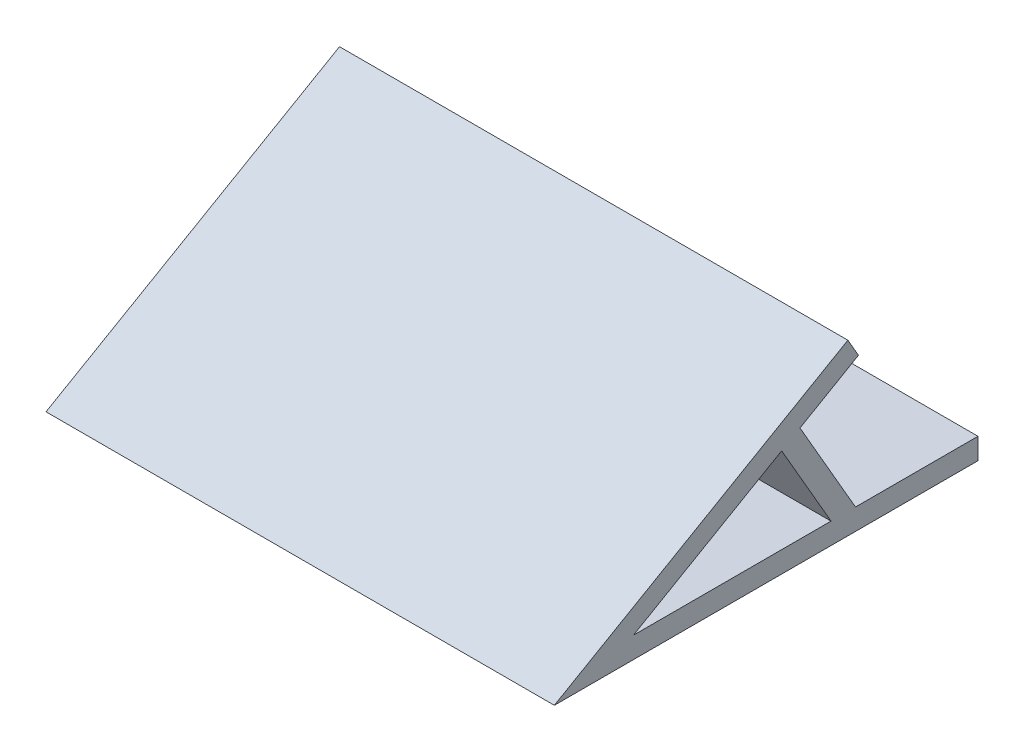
SolidWorks part; units mm, degrees
ref_plane "Front Plane" through (0, 0, 0) normal (0, 0, 1) x (1, 0, 0)
ref_plane "Top Plane" through (0, 0, 0) normal (0, 1, 0) x (1, 0, 0)
ref_plane "Right Plane" through (0, 0, 0) normal (1, 0, 0) x (0, 0, -1)
sketch "Sketch1" plane through (0, 0, 0) normal (1, 0, 0) x (0, 0, -1)
  line L0 (0, 0) -> (-41.0994, 0)
  line L1 (-41.0994, 0) -> (-6.4584, 20)
  line L2 (-6.4584, 20) -> (-5.2084, 17.8349)
  line L3 (-5.2084, 17.8349) -> (-12.1104, 13.85)
  line L4 (-31.7693, 2.5) -> (-8.4442, 2.5)
  line L5 (8.9006, 2.5) -> (8.9006, 0)
  line L6 (8.9006, 0) -> (0, 0)
  line L7 (-14.2755, 12.6) -> (-8.4442, 2.5)
  line L8 (-12.1104, 13.85) -> (-5.5575, 2.5)
  line L9 (-12.1104, 13.85) -> (-14.2755, 12.6) construction
  line L10 (-14.2755, 12.6) -> (-31.7693, 2.5)
  line L11 (-8.4442, 2.5) -> (-5.5575, 2.5) construction
  line L12 (-5.5575, 2.5) -> (8.9006, 2.5)
  point P12 (0, 0)
  dimension "D1" = 2.5
  dimension "D2" = 30
  dimension "D3" = 40
  dimension "D4" = 8.9006
  dimension "D5" = 50
extrude "Boss-Extrude1" add sketch "Sketch1" along normal blind 60 contours L12 L8 L3 L2 L1 L0 L6 L5 L10 L7 L4
